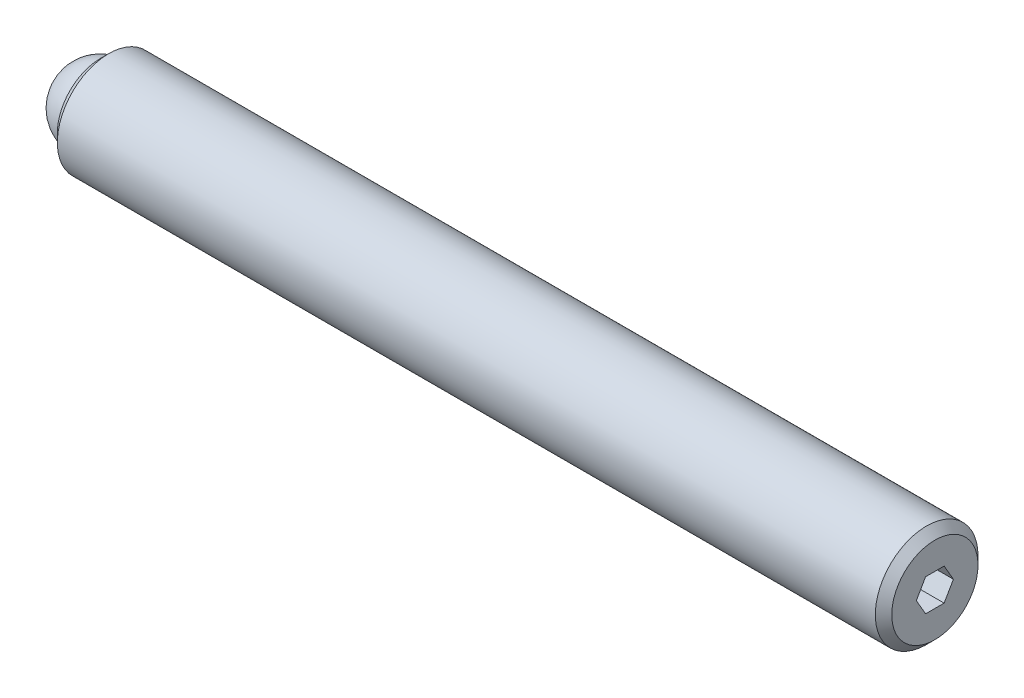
SolidWorks part; units mm, degrees
ref_plane "Front Plane" through (0, 0, 0) normal (0, 0, 1) x (1, 0, 0)
ref_plane "Top Plane" through (0, 0, 0) normal (0, 1, 0) x (1, 0, 0)
ref_plane "Right Plane" through (0, 0, 0) normal (1, 0, 0) x (0, 0, -1)
sketch "Sketch2" plane through (0, 0, 0) normal (1, 0, 0) x (0, 0, -1)
  circle A0 centre (0, 0) radius 3.175
  dimension "D1" = 6.35
extrude "Boss-Extrude1" add sketch "Sketch2" along normal blind 51.5938
sketch "Sketch3" plane through (0, 0, 0) normal (-1, 0, 0) x (0, 0, 1)
  circle A0 centre (0, 0) radius 2.3813
  dimension "D1" = 4.7625
chamfer "Chamfer1" distance 0.508 angle 45 1 edges at (0, 0, -3.175)
chamfer "Chamfer2" distance 0.508 angle 45 1 edges at (51.5938, 0, -3.175)
sketch "Sketch4" plane through (51.5938, 0, 0) normal (1, 0, 0) x (0, 0, -1)
  line L1 (1.1457, 0) -> (0.5728, 0.9922)
  line L2 (0.5728, 0.9922) -> (-0.5728, 0.9922)
  line L3 (-0.5728, 0.9922) -> (-1.1457, 0)
  line L4 (-1.1457, 0) -> (-0.5728, -0.9922)
  line L5 (-0.5728, -0.9922) -> (0.5728, -0.9922)
  line L6 (0.5728, -0.9922) -> (1.1457, 0)
  circle A0 centre (0, 0) radius 0.9922 construction
  dimension "D1" = 1.9844
extrude "Cut-Extrude2" cut sketch "Sketch4" against normal blind 2.286
extrude "Cut-Extrude3" cut sketch "Sketch3" against normal blind 1.9844
sketch "Sketch5" plane through (0, 0, 0) normal (-1, 0, 0) x (0, 0, 1)
  line L0 (0, 0) -> (0, -2.3813)
  line L1 (0, 0) -> (0, 2.3813)
  arc A0 (0, 2.3813) -> (0, -2.3813) centre (0, 0) ccw
  dimension "D1" = 2.3813
revolve "Revolve1" add sketch "Sketch5" angle 360 about L1
